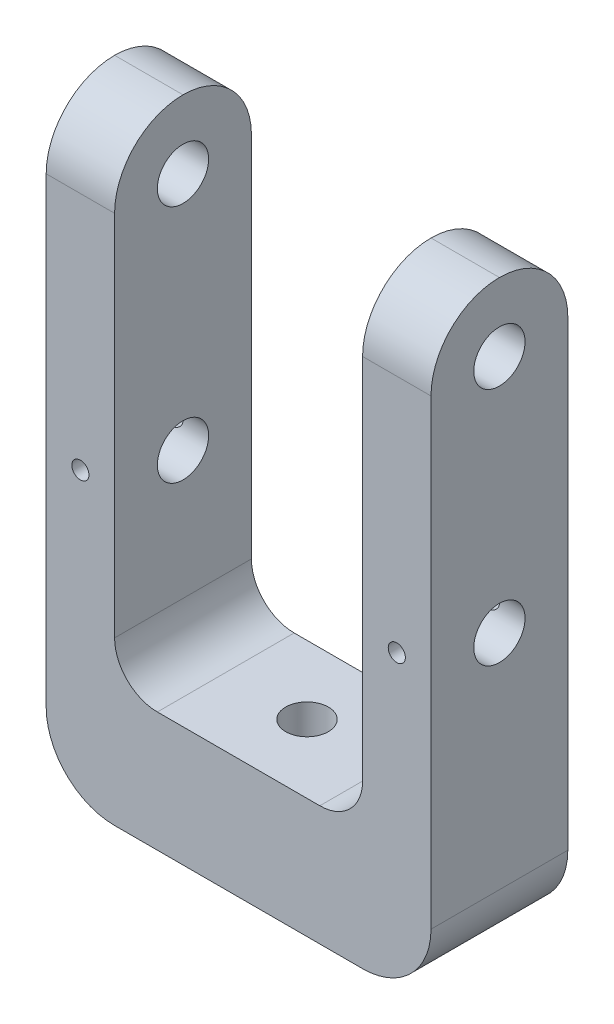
SolidWorks part; units mm, degrees
ref_plane "Frontal" through (0, 0, 0) normal (0, 0, 1) x (1, 0, 0)
ref_plane "Horizontal" through (0, 0, 0) normal (0, 1, 0) x (1, 0, 0)
ref_plane "Vertical" through (0, 0, 0) normal (1, 0, 0) x (0, 0, -1)
sketch "Esquisse1" plane through (0, 0, 0) normal (0, 0, 1) x (1, 0, 0)
  line L0 (-71.2975, 0) -> (70.9203, 0) construction
  line L1 (0, -12.3349) -> (0, 87.1717) construction
  line L2 (22.5, 70) -> (14.5, 70)
  line L3 (-14.5, 70) -> (-22.5, 70)
  line L4 (-22.5, 70) -> (-22.5, 0)
  line L5 (-22.5, 0) -> (22.5, 0)
  line L6 (22.5, 70) -> (22.5, 0)
  line L7 (-22.5, 70) -> (22.5, 0) construction
  line L8 (-22.5, 0) -> (22.5, 70) construction
  line L9 (-14.5, 14) -> (14.5, 14)
  line L10 (-14.5, 14) -> (-14.5, 70)
  line L11 (18.5, 56.6295) -> (18.5, 20.5828) construction
  line L12 (14.5, 14) -> (14.5, 70)
  line L13 (-14.5, 14) -> (14.5, 70) construction
  line L14 (-14.5, 70) -> (14.5, 14) construction
  line L15 (-18.5, 56.6295) -> (-18.5, 20.5828) construction
  line L16 (-38.1551, 34) -> (33.4179, 34) construction
  circle A0 centre (18.5, 34) radius 1
  circle A1 centre (-18.5, 34) radius 1
  point P5 (0, 35)
  point P10 (0, 42)
  point P15 (0, 0)
  dimension "D7" = 2
  dimension "D1" = 29
  dimension "D2" = 45
  dimension "D3" = 70
  dimension "D4" = 14
  dimension "D5" = 37
  dimension "D6" = 34
extrude "Extrusion1" add sketch "Esquisse1" along normal mid plane 16
fillet "Congé1" radius 5 2 edges at (-14.5, 14, 0) (14.5, 14, 0)
fillet "Congé2" radius 8 2 edges at (-22.5, 0, 0) (22.5, 0, 0)
fillet "Congé3" radius 8 4 edges at (18.5, 70, -8) (18.5, 70, 8) (-18.5, 70, -8) (-18.5, 70, 8)
sketch "Esquisse2" plane through (22.5, 0, 0) normal (1, 0, 0) x (0, 0, -1)
  line L0 (0, -11.0697) -> (0, 81.2328) construction
  line L1 (8, 0) -> (-8, 0) construction
  circle A0 centre (0, 34) radius 3
  circle A1 centre (0, 62) radius 3
  dimension "D1" = 6
  dimension "D3" = 6
  dimension "D2" = 34
  dimension "D4" = 62
extrude "Extrusion2" cut sketch "Esquisse2" against normal through all
hole_wizard "Trou taraudé M61" positions "Esquisse4" profile "Esquisse3" tap size "M6" standard "ISO"
sketch "Esquisse4" plane through (0, 0, 0) normal (0, -1, 0) x (1, 0, 0)
  point P0 (0, 0)
sketch "Esquisse3" plane through (0, 0, 0) normal (1, 0, 0) x (0, 0, -1)
  line L0 (0, 0) -> (0, 70)
  line L1 (0, 70) -> (2.5, 70)
  line L2 (2.5, 70) -> (2.5, 0)
  line L5 (2.5, 0) -> (0, 0)
  line L11 (0, -6.35) -> (0, 107.95) construction
  dimension "Diamètre du trou pour taraudage jusqu'au prochain" = 5
  dimension "Profondeur du trou pour taraudage jusqu'au prochain" = 70
